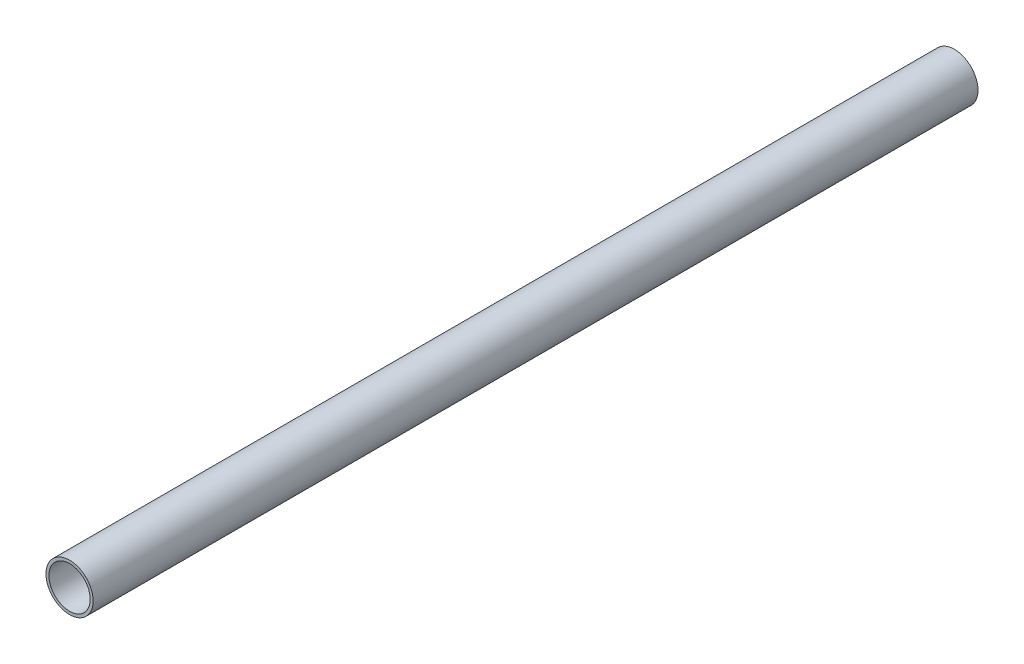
SolidWorks part; units mm, degrees
ref_plane "Front Plane" through (0, 0, 0) normal (0, 0, 1) x (1, 0, 0)
ref_plane "Top Plane" through (0, 0, 0) normal (0, 1, 0) x (1, 0, 0)
ref_plane "Right Plane" through (0, 0, 0) normal (1, 0, 0) x (0, 0, -1)
sketch "Sketch1" plane through (0, 0, 0) normal (0, 0, 1) x (1, 0, 0)
  circle A0 centre (0, 0) radius 7
  circle A1 centre (0, 0) radius 8
  dimension "D1" = 16
  dimension "D2" = 14
extrude "Boss-Extrude1" add sketch "Sketch1" along normal blind 300
